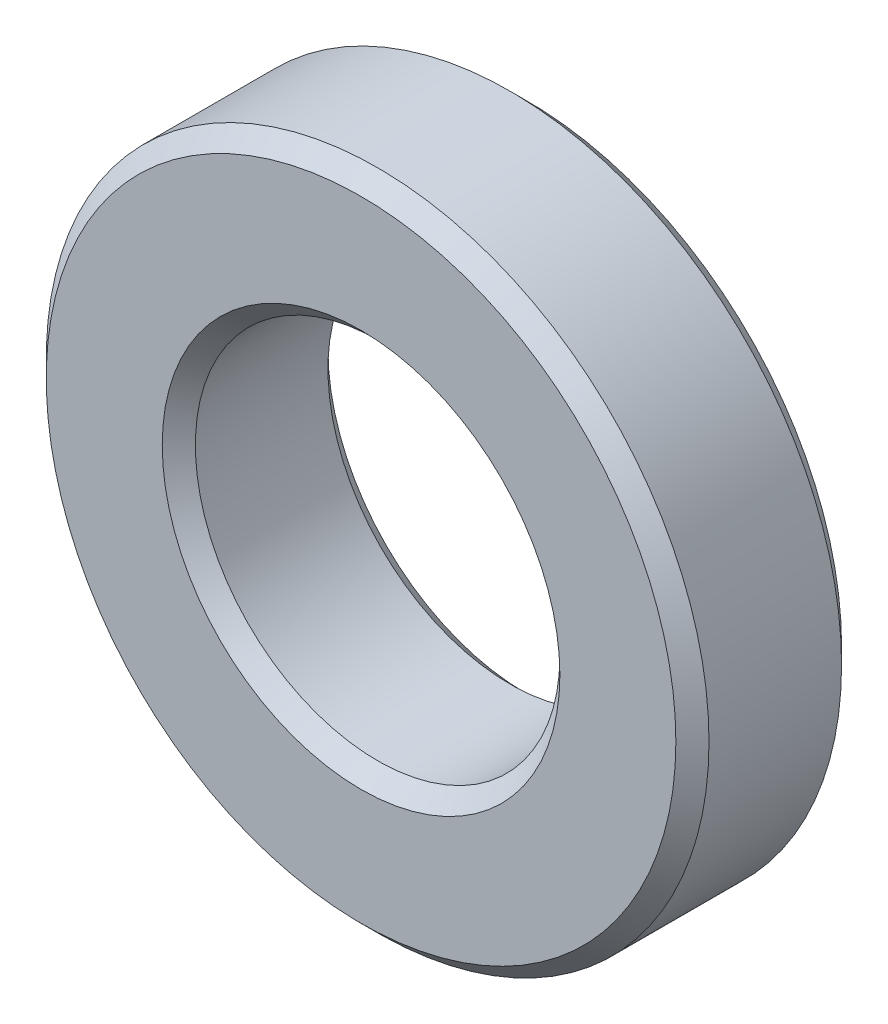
SolidWorks part; units mm, degrees
ref_plane "Front Plane" through (0, 0, 0) normal (0, 0, 1) x (1, 0, 0)
ref_plane "Top Plane" through (0, 0, 0) normal (0, 1, 0) x (1, 0, 0)
ref_plane "Right Plane" through (0, 0, 0) normal (1, 0, 0) x (0, 0, -1)
sketch "Sketch1" plane through (0, 0, 0) normal (0, 0, 1) x (1, 0, 0)
  circle A0 centre (0, 0) radius 2
  circle A1 centre (0, 0) radius 1.1
  dimension "D1" = 4
  dimension "D2" = 2.2
extrude "Boss-Extrude2" add sketch "Sketch1" along normal mid plane 1
chamfer "Chamfer3" distance 0.1 angle 45 4 edges at (2, 0, 0.5) (2, 0, -0.5) (1.1, 0, -0.5) (1.1, 0, 0.5)
